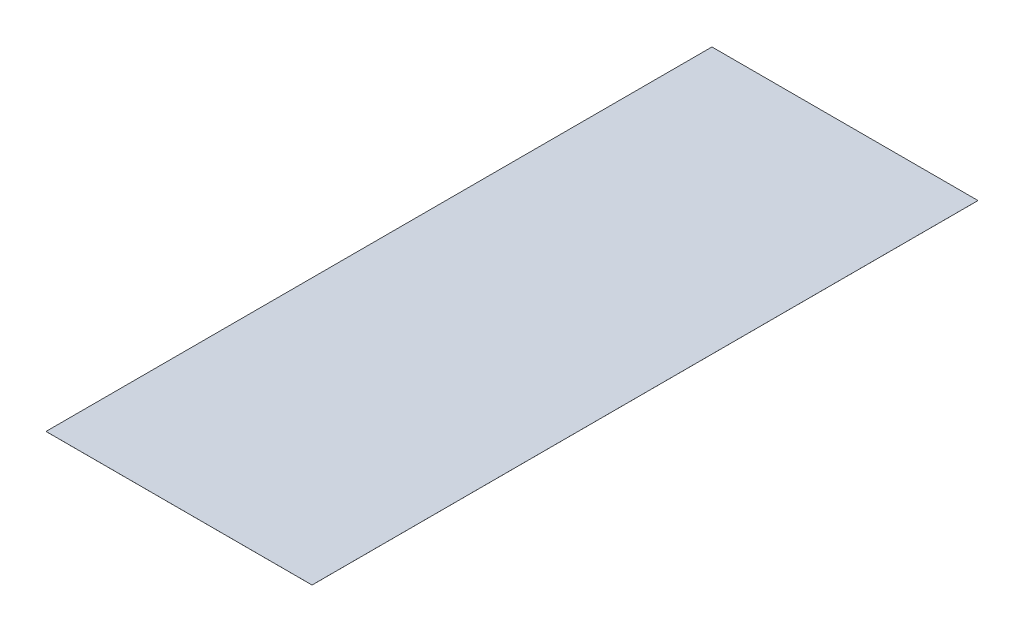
SolidWorks part; units mm, degrees
ref_plane "Plan de face" through (0, 0, 0) normal (0, 0, 1) x (1, 0, 0)
ref_plane "Plan de dessus" through (0, 0, 0) normal (0, 1, 0) x (1, 0, 0)
ref_plane "Plan de droite" through (0, 0, 0) normal (1, 0, 0) x (0, 0, -1)
sketch "Esquisse1" plane through (0, 0, 0) normal (0, 0, 1) x (1, 0, 0)
  line L0 (-2000, 0) -> (2000, 0)
  line L1 (2000, 0) -> (2000, 0.5)
  line L2 (2000, 0.5) -> (-2000, 0.5)
  line L3 (-2000, 0.5) -> (-2000, 0)
  dimension "D1" = 4000
  dimension "D2" = 2000
  dimension "D3" = 0.5
extrude "Boss.-Extru.1" add sketch "Esquisse1" along normal blind 10012.49
